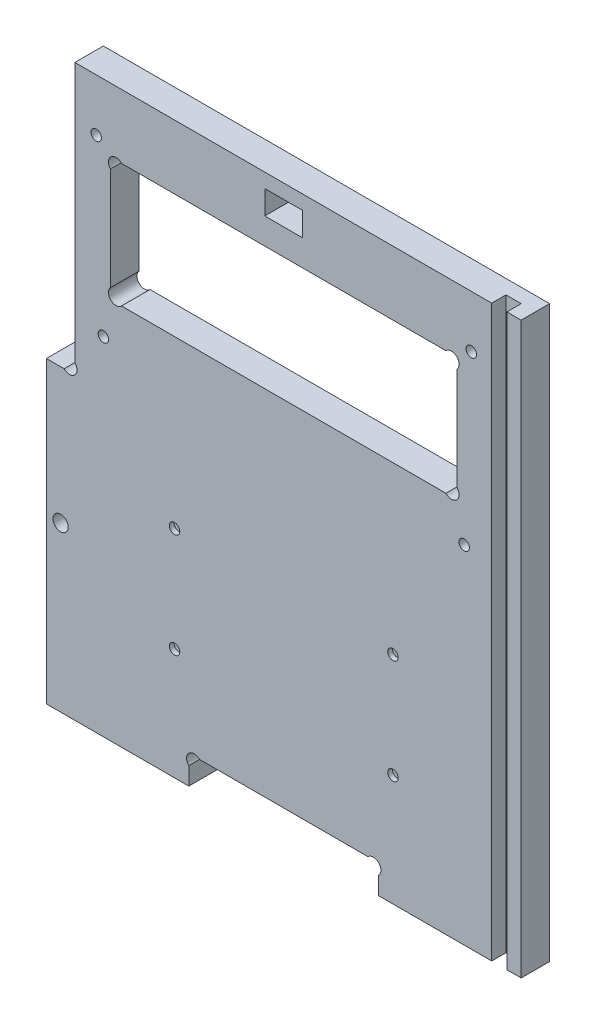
SolidWorks part; units mm, degrees
ref_plane "Plan de face" through (0, 0, 0) normal (0, 0, 1) x (1, 0, 0)
ref_plane "Plan de dessus" through (0, 0, 0) normal (0, 1, 0) x (1, 0, 0)
ref_plane "Plan de droite" through (0, 0, 0) normal (1, 0, 0) x (0, 0, -1)
sketch "Esquisse1" plane through (0, 0, 0) normal (0, 0, 1) x (1, 0, 0)
  line L0 (75.1067, 0) -> (-56.1865, 0) construction
  line L1 (75.1067, 114) -> (-56.1865, 114) construction
  line L2 (0, -4.9573) -> (0, 128.4779) construction
  line L3 (50, -15.4988) -> (50, 135.6333) construction
  line L4 (-50, -15.4988) -> (-50, 135.6333) construction
  line L5 (44, 50.1041) -> (44, 121.3123) construction
  line L6 (69.4245, 57) -> (39, 57) construction
  line L7 (69.4245, 28.5) -> (-16.2816, 28.5) construction
  line L8 (47, 33.2774) -> (47, 17.5) construction
  line L9 (-38, 74.5) -> (-38, 64.1524) construction
  line L10 (-44, 114) -> (50, 114)
  line L11 (50, 114) -> (50, -6)
  line L12 (-56.1865, 108.5) -> (4.3343, 108.5) construction
  line L13 (-50, 57) -> (-50, -6)
  line L14 (-46.2627, 57) -> (-50, 57)
  line L15 (-44, 59.2627) -> (-44, 114)
  line L16 (20, 0) -> (4.3343, -15.6657) construction
  line L17 (-42, 107) -> (42, 107) construction
  line L18 (-42, 107) -> (-42, 63) construction
  line L19 (-42, 63) -> (42, 63) construction
  line L20 (44, 57) -> (55.7507, 68.7507) construction
  line L21 (42, 107) -> (42, 63) construction
  line L22 (-27.8545, 67) -> (-40.6187, 67) construction
  line L24 (75.1067, -6) -> (-56.1865, -6) construction
  line L25 (20, 1.6152) -> (20, -17.4159) construction
  line L26 (50, -6) -> (20, -6)
  line L27 (20, -6) -> (20, -2.2627)
  line L28 (17.7373, 0) -> (-17.7373, 0)
  line L29 (-20, -2.2627) -> (-20, -6)
  line L30 (-20, -6) -> (-50, -6)
  line L31 (-40.6187, 103) -> (-27.8545, 103) construction
  line L32 (-39.5, 105.664) -> (-39.5, 92.0576) construction
  line L33 (4, 111) -> (-4, 111)
  line L34 (-34.1592, 100.5) -> (34.1592, 100.5)
  line L35 (-36.5, 98.3181) -> (-36.5, 76.6819)
  line L36 (-34.1592, 74.5) -> (34.1592, 74.5)
  line L37 (36.5, 98.3181) -> (36.5, 76.6819)
  line L38 (-13.0067, 87.5) -> (4.3343, 87.5) construction
  line L39 (4, 111) -> (4, 106)
  line L40 (4, 106) -> (-4, 106)
  line L41 (-4, 111) -> (-4, 106)
  line L42 (4, 111) -> (-4, 106) construction
  line L43 (4, 106) -> (-4, 111) construction
  circle A0 centre (-39.5, 103) radius 1.1
  circle A1 centre (-38, 67) radius 1.1
  circle A2 centre (39.5, 103) radius 1.1
  circle A3 centre (38, 67) radius 1.1
  arc A9 (-44, 59.2627) -> (-46.2627, 57) centre (-45.1314, 58.1314) cw
  circle A10 centre (-47, 28.5) radius 1.6
  arc A11 (20, -2.2627) -> (17.7373, 0) centre (18.8686, -1.1314) ccw
  arc A12 (-20, -2.2627) -> (-17.7373, 0) centre (-18.8686, -1.1314) cw
  arc A14 (-36.5, 76.6819) -> (-34.1592, 74.5) centre (-35.3296, 75.5909) ccw
  arc A15 (-36.5, 98.3181) -> (-34.1592, 100.5) centre (-35.3296, 99.4091) cw
  arc A16 (36.5, 98.3181) -> (34.1592, 100.5) centre (35.3296, 99.4091) ccw
  arc A17 (36.5, 76.6819) -> (34.1592, 74.5) centre (35.3296, 75.5909) cw
  point P45 (0, 108.5)
  dimension "D8" = 2
  dimension "D11" = 45
  dimension "D12" = 7
  dimension "D14" = 4
  dimension "D15" = 6
  dimension "D18" = 4
  dimension "D20" = 6.5
  dimension "D26" = 13
  dimension "D24" = 5.5
  dimension "D1" = 114
  dimension "D2" = 50
  dimension "D3" = 100
  dimension "D4" = 57
  dimension "D5" = 6
  dimension "D6" = 28.5
  dimension "D7" = 3
  dimension "D9" = 84
  dimension "D10" = 44
  dimension "D13" = 4
  dimension "D16" = 30
  dimension "D17" = 45
  dimension "D19" = 2.5
  dimension "D21" = 5.5
  dimension "D22" = 5.5
  dimension "D23" = 26
extrude "Boss.-Extru.1" add sketch "Esquisse1" along normal blind 6
sketch "Esquisse2" plane through (0, 0, 6) normal (0, 0, -1) x (-1, 0, 0)
  line L0 (-33.3531, 39.5) -> (-21.0753, 39.5) construction
  line L1 (-23, 48.7941) -> (-23, 36.5163) construction
  line L3 (-20, -6) -> (-50, -6) construction
  line L4 (-50, -6) -> (-50, 114) construction
  circle A0 centre (-23, 39.5) radius 1.1
  circle A1 centre (23, 39.5) radius 1.1
  circle A2 centre (-23, 17.5) radius 1.1
  circle A3 centre (23, 17.5) radius 1.1
  dimension "D3" = 27
  dimension "D4" = 45.5
  dimension "D1" = 2
  dimension "D2" = 2
extrude "Enlèv. mat.-Extru.3" cut sketch "Esquisse2" along normal blind 1
sketch "Esquisse3" plane through (0, 0, 6) normal (0, 0, 1) x (1, 0, 0)
  line L0 (50, -10.541) -> (50, 132.6919) construction
  line L1 (47, 125.1408) -> (47, -10.541) construction
  line L2 (43.8, 132.6919) -> (43.8, -10.541) construction
  line L4 (43.8, 117.1816) -> (47, 117.1816)
  line L5 (43.8, 117.1816) -> (43.8, -7.9211)
  line L6 (43.8, -7.9211) -> (47, -7.9211)
  line L7 (47, 117.1816) -> (47, -7.9211)
  dimension "D1" = 3
  dimension "D2" = 6.2
extrude "Enlèv. mat.-Extru.4" cut sketch "Esquisse3" against normal blind 3
